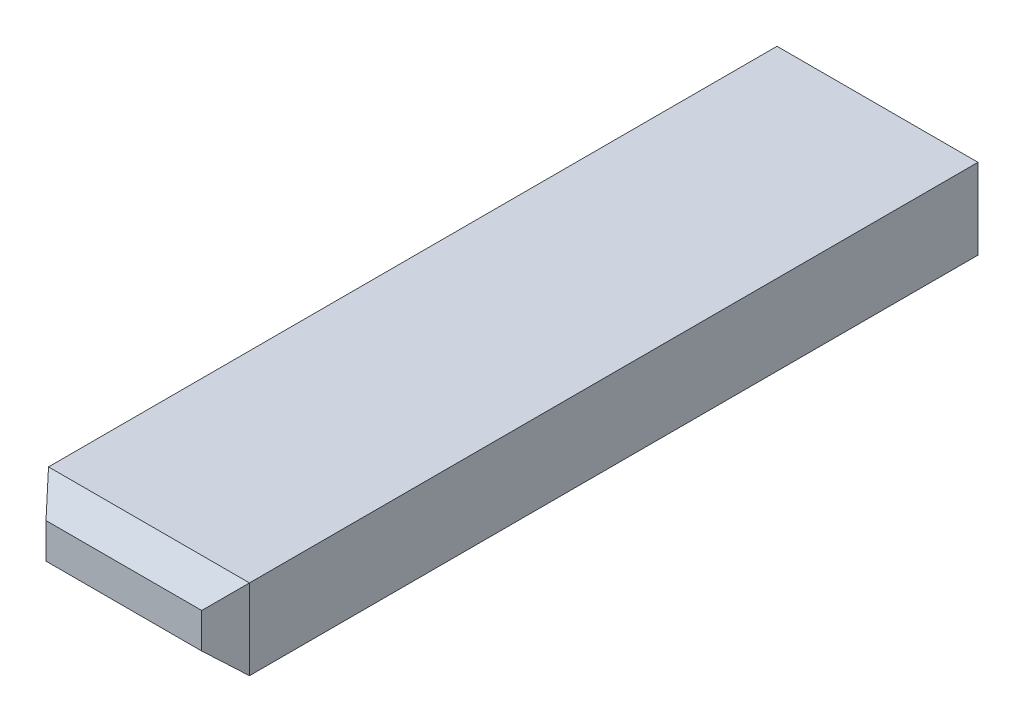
SolidWorks part; units mm, degrees
ref_plane "Plan de face" through (0, 0, 0) normal (0, 0, 1) x (1, 0, 0)
ref_plane "Plan de dessus" through (0, 0, 0) normal (0, 1, 0) x (1, 0, 0)
ref_plane "Plan de droite" through (0, 0, 0) normal (1, 0, 0) x (0, 0, -1)
sketch "Esquisse1" plane through (0, 0, 0) normal (0, 0, 1) x (1, 0, 0)
  line L1 (0, 0) -> (4, 0)
  line L2 (0, 0) -> (0, 1.6)
  line L3 (0, 1.6) -> (4, 1.6)
  line L4 (4, 0) -> (4, 1.6)
  dimension "D1" = 1.6
  dimension "D2" = 4
extrude "Extrusion1" add sketch "Esquisse1" along normal blind 15
chamfer "Chanfrein1" distance 0.5 angle 42 4 edges at (2, 1.6, 15) (4, 0.8, 15) (2, 0, 15) (0, 0.8, 15)
